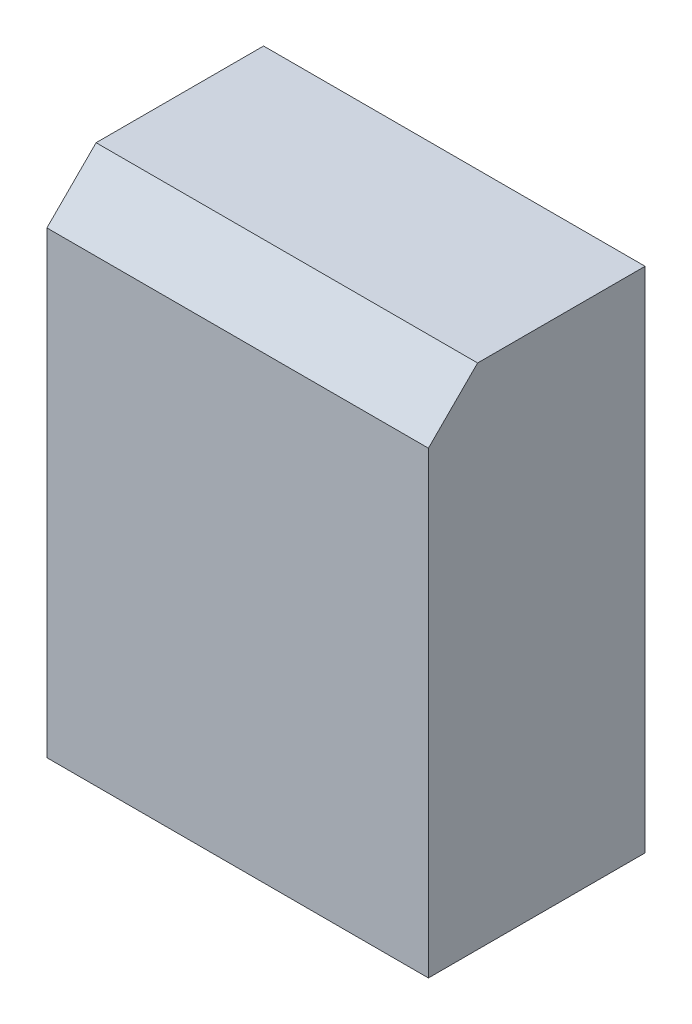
SolidWorks part; units mm, degrees
ref_plane "Ebene vorne" through (0, 0, 0) normal (0, 0, 1) x (1, 0, 0)
ref_plane "Ebene oben" through (0, 0, 0) normal (0, 1, 0) x (1, 0, 0)
ref_plane "Ebene rechts" through (0, 0, 0) normal (1, 0, 0) x (0, 0, -1)
sketch "Sketch1" plane through (0, 0, 0) normal (0, 1, 0) x (1, 0, 0)
  line L1 (-32.7002, 16.6203) -> (44.8614, 16.6203)
  line L2 (-32.7002, 16.6203) -> (-32.7002, -27.4303)
  line L3 (-32.7002, -27.4303) -> (44.8614, -27.4303)
  line L4 (44.8614, 16.6203) -> (44.8614, -27.4303)
extrude "Boss-Extrude1" add sketch "Sketch1" along normal blind 103.2853
chamfer "Chamfer1" distance 10 angle 45 1 edges at (6.0806, 103.2853, 27.4303)
